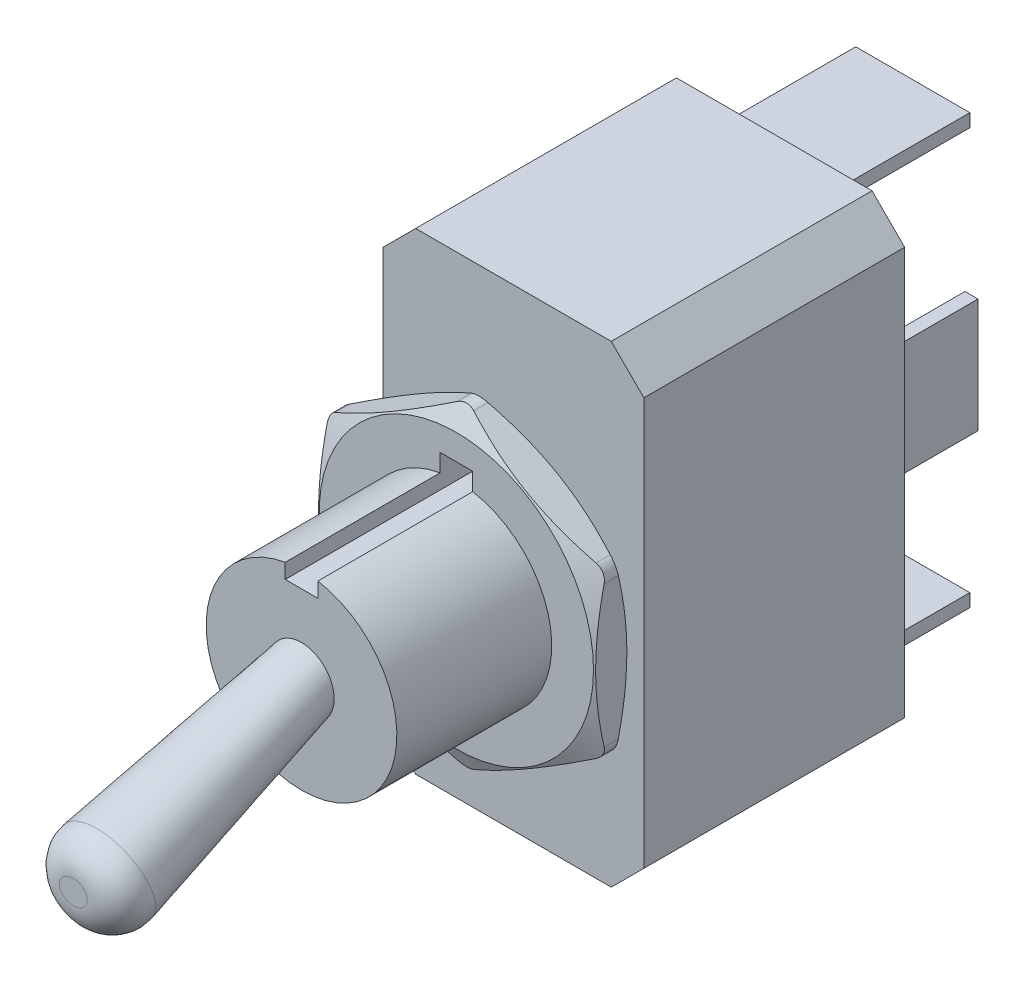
SolidWorks part; units mm, degrees
ref_plane "Front" through (0, 0, 0) normal (0, 0, 1) x (1, 0, 0)
ref_plane "Top" through (0, 0, 0) normal (0, 1, 0) x (1, 0, 0)
ref_plane "Right" through (0, 0, 0) normal (1, 0, 0) x (0, 0, -1)
sketch "Sketch1" plane through (0, 0, 0) normal (0, 0, 1) x (1, 0, 0)
  line L0 (-8, -14.5) -> (8, 14.5) construction
  line L1 (-8, 14.5) -> (8, 14.5)
  line L2 (-8, 14.5) -> (-8, -14.5)
  line L3 (-8, -14.5) -> (8, -14.5)
  line L4 (8, 14.5) -> (8, -14.5)
  dimension "D1" = 16
  dimension "D2" = 29
extrude "Extrude1" add sketch "Sketch1" along normal mid plane 16
sketch "Sketch2" plane through (0, 0, 8) normal (0, 0, 1) x (1, 0, 0)
  circle A0 centre (0, 0) radius 5.85
  dimension "D1" = 11.7
extrude "Extrude2" add sketch "Sketch2" along normal blind 13
chamfer "Chamfer1" distance 2 angle 45 4 edges at (8, -14.5, 0) (-8, -14.5, 0) (-8, 14.5, 0) (8, 14.5, 0)
ref_plane "Plane1" through (0, 0, 35) normal (0, 0, 1) x (1, 0, 0)
sketch "Sketch3" plane through (0, 0, 35) normal (0, 0, 1) x (1, 0, 0)
  circle A0 centre (0, -5.0285) radius 3
  dimension "D1" = 6
sketch "Sketch4" plane through (0, 0, 21) normal (0, 0, 1) x (1, 0, 0)
  circle A0 centre (0, 0) radius 2
  dimension "D1" = 4
loft "Loft1" add profiles "Sketch4", "Sketch3"
fillet "Fillet1" radius 2 1 edges at (3, -5.0285, 35)
ref_plane "Plane2" through (0, 0, 9.5) normal (0, 0, 1) x (1, 0, 0)
sketch "Sketch5" plane through (0, 0, 9.5) normal (0, 0, 1) x (1, 0, 0)
  line L1 (0, 9.815) -> (-8.5, 4.9075)
  line L2 (-8.5, 4.9075) -> (-8.5, -4.9075)
  line L3 (-8.5, -4.9075) -> (0, -9.815)
  line L4 (0, -9.815) -> (8.5, -4.9075)
  line L5 (8.5, -4.9075) -> (8.5, 4.9075)
  line L6 (8.5, 4.9075) -> (0, 9.815)
  circle A0 centre (0, 0) radius 8.5 construction
  dimension "D1" = 17
extrude "Extrude3" add sketch "Sketch5" along normal blind 2
sketch "Sketch6" plane through (0, 0, 0) normal (1, 0, 0) x (0, 0, -1)
  line L0 (1.9206, 0) -> (-19.0852, 0) construction
  line L1 (-11.6987, 10.015) -> (-10.6987, 10.015)
  line L2 (-10.6987, 10.015) -> (-11.6987, 8.015)
  line L3 (-11.6987, 8.015) -> (-11.6987, 10.015)
  line L4 (-11.5, 4.9075) -> (-11.5, 9.815) construction
  line L5 (-11.5, 9.815) -> (-9.5, 9.815) construction
  line L6 (-10.3, 10.015) -> (-9.3, 8.015)
  line L7 (-9.3, 8.015) -> (-9.3, 10.015)
  line L8 (-9.3, 10.015) -> (-10.3, 10.015)
  line L9 (-9.5, 4.9075) -> (-9.5, 9.815) construction
  dimension "D1" = 0.1987
  dimension "D2" = 0.2
  dimension "D3" = 1
  dimension "D4" = 2
  dimension "D5" = 0.2
  dimension "D6" = 2
  dimension "D7" = 0.2
  dimension "D8" = 1
revolve "Cut-Revolve1" cut sketch "Sketch6" angle 360 about L0
fillet "Fillet2" radius 1 6 edges at (0, 9.815, 10.4994) (8.5, 4.9075, 10.4994) (8.5, -4.9075, 10.4994) (0, -9.815, 10.4994) (-8.5, -4.9075, 10.4994) (-8.5, 4.9075, 10.4994)
sketch "Esboço1" plane through (0, 0, -8) normal (0, 0, -1) x (-1, 0, 0)
  line L0 (-6, 14.5) -> (6, 14.5) construction
  line L1 (-3.5, 12.35) -> (3.5, 12.35)
  line L2 (-3.5, 12.35) -> (-3.5, 13.15)
  line L3 (-3.5, 13.15) -> (3.5, 13.15)
  line L4 (3.5, 12.35) -> (3.5, 13.15)
  line L5 (-3.5, 12.35) -> (3.5, 13.15) construction
  line L6 (-3.5, 13.15) -> (3.5, 12.35) construction
  line L7 (-3.2, 3.5) -> (-4, 3.5)
  line L8 (-3.2, 3.5) -> (-3.2, -3.5)
  line L9 (-3.2, -3.5) -> (-4, -3.5)
  line L10 (-4, 3.5) -> (-4, -3.5)
  line L11 (-3.2, 3.5) -> (-4, -3.5) construction
  line L12 (-3.2, -3.5) -> (-4, 3.5) construction
  line L13 (0, 0) -> (7.0515, 0) construction
  line L14 (3.5, -12.35) -> (3.5, -13.15)
  line L15 (-3.5, -13.15) -> (3.5, -13.15)
  line L16 (-3.5, -12.35) -> (-3.5, -13.15)
  line L17 (-3.5, -12.35) -> (3.5, -12.35)
  line L18 (-8, -12.5) -> (-8, 12.5) construction
  point P0 (0, 12.75)
  point P5 (-3.6, 0)
  dimension "D1" = 7
  dimension "D2" = 0.8
  dimension "D3" = 1.35
  dimension "D4" = 7
  dimension "D5" = 0.8
  dimension "D6" = 4
extrude "Ressalto-extrusão1" add sketch "Esboço1" along normal blind 8.5
sketch "Esboço2" plane through (0, 0, 21) normal (0, 0, 1) x (1, 0, 0)
  line L1 (-1, 4.85) -> (1, 4.85)
  line L2 (-1, 4.85) -> (-1, 6.85)
  line L3 (-1, 6.85) -> (1, 6.85)
  line L4 (1, 4.85) -> (1, 6.85)
  line L5 (-1, 4.85) -> (1, 6.85) construction
  line L6 (-1, 6.85) -> (1, 4.85) construction
  circle A3 centre (0, 0) radius 5.85 construction
  circle A4 centre (0, 0) radius 5.85 construction
  point P0 (0, 5.85)
  dimension "D1" = 2
  dimension "D2" = 2
extrude "Corte-extrusão2" cut sketch "Esboço2" against normal blind 12.5
